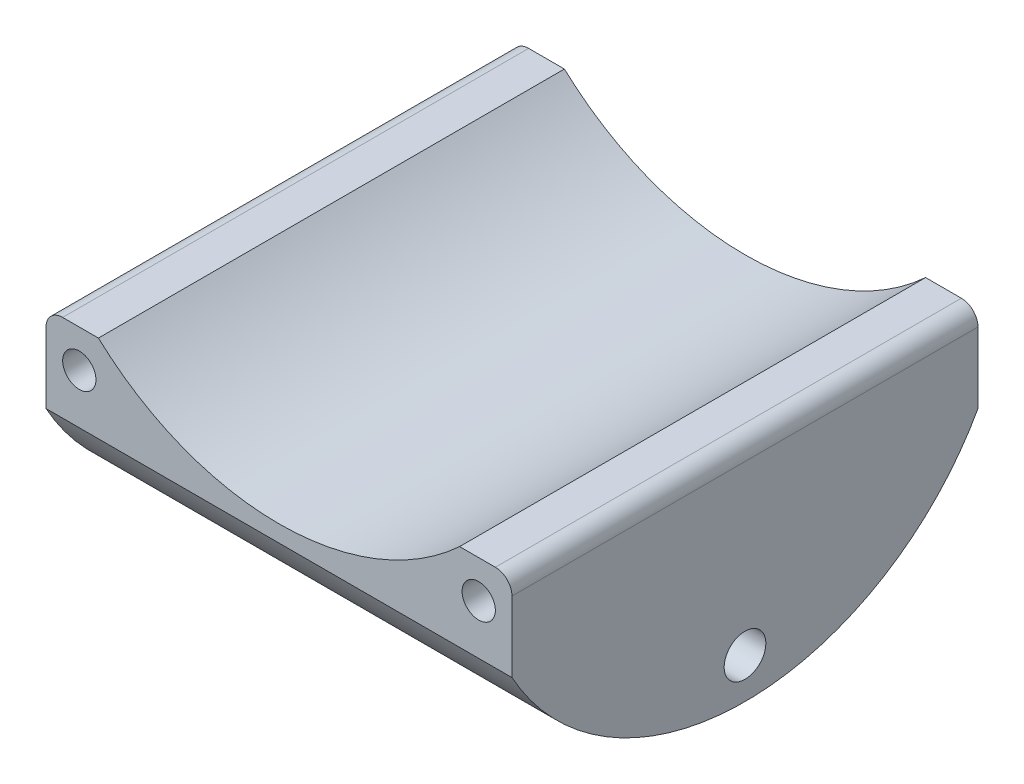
SolidWorks part; units mm, degrees
ref_plane "Front" through (0, 0, 0) normal (0, 0, 1) x (1, 0, 0)
ref_plane "Top" through (0, 0, 0) normal (0, 1, 0) x (1, 0, 0)
ref_plane "Right" through (0, 0, 0) normal (1, 0, 0) x (0, 0, -1)
sketch "Sketch1" plane through (0, 0, 0) normal (1, 0, 0) x (0, 0, -1)
  line L0 (-44.45, 0) -> (44.45, 0)
  line L1 (0, 55.88) -> (0, -72.5415) construction
  line L2 (-44.45, 0) -> (-44.45, -16.6432)
  line L3 (44.45, 0) -> (44.45, -16.6432)
  arc A0 (-44.45, -16.6432) -> (44.45, -16.6432) centre (0, 7.9502) ccw
  dimension "D1" = 50.8
  dimension "D2" = 42.8498
  dimension "D3" = 88.9
extrude "Base-Extrude" add sketch "Sketch1" along normal mid plane 88.9
sketch "Sketch2" plane through (0, 0, 44.45) normal (0, 0, 1) x (1, 0, 0)
  line L0 (44.45, 0) -> (-44.45, 0) construction
  line L1 (0, -50) -> (0, 50) construction
  line L2 (44.45, -16.6432) -> (-44.45, -16.6432) construction
  arc A0 (-34.4526, 0) -> (34.4526, 0) centre (0, 37.3318) ccw
  dimension "D1" = 50.8
  dimension "D2" = 53.975
extrude "Cut-Extrude1" cut sketch "Sketch2" against normal through all
fillet "Fillet1" radius 3.175 2 edges at (44.45, 0, 0) (-44.45, 0, 0)
other "Hole1" parameters "D1"=20.6375
sketch "Sketch3" plane through (0, 0, 44.45) normal (0, 0, 1) x (1, 0, 0)
  line L0 (-34.4526, 0) -> (-41.275, 0) construction
  line L1 (0, -50) -> (0, 50) construction
  circle A0 centre (-38.1, -7.1374) radius 3.175
  dimension "D1" = 6.35
  dimension "D2" = 7.1374
  dimension "D3" = 38.1
pattern_linear "LPattern1" count 2 spacing 76.2 along (1, 0, 0) of "Hole1"
mirror "Mirror1" about plane through (0, 0, 0) normal (0, 0, 1) of "LPattern1"
other "Hole2" parameters "D1"=17.4625
sketch "Sketch4" plane through (44.45, 0, 0) normal (1, 0, 0) x (0, 0, -1)
  line L0 (0, 50) -> (0, -50) construction
  line L1 (-44.45, 0) -> (44.45, 0) construction
  circle A0 centre (0, -35.179) radius 3.9751
  dimension "D1" = 7.9502
  dimension "D2" = 35.179
mirror "Mirror2" about plane through (0, 0, 0) normal (1, 0, 0) of "Hole2"
